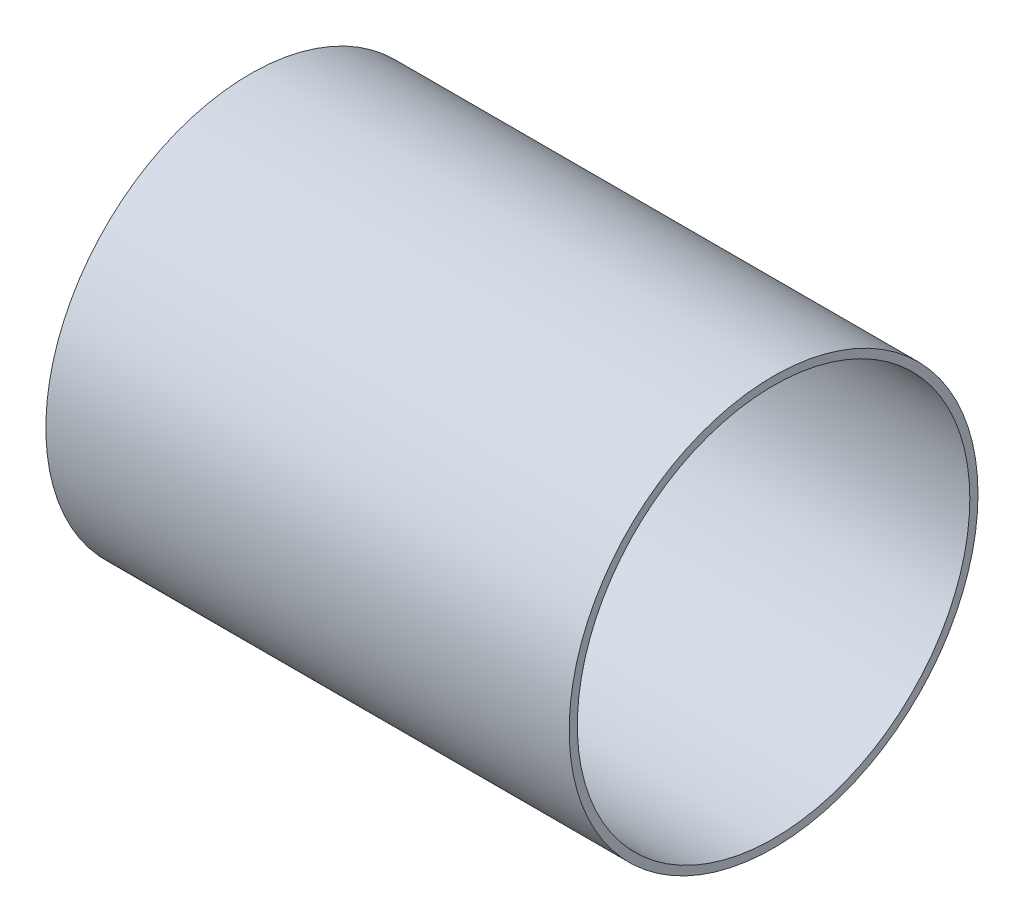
SolidWorks part; units mm, degrees
ref_plane "Front Plane" through (0, 0, 0) normal (1, 0, 0) x (0, 1, 0)
ref_plane "Top Plane" through (0, 0, 0) normal (0, 0, 1) x (0, 1, 0)
ref_plane "Right Plane" through (0, 0, 0) normal (0, 1, 0) x (-1, 0, 0)
sketch "Sketch1" plane through (0, 0, 0) normal (1, 0, 0) x (0, 1, 0)
  circle A0 centre (0, 0) radius 79.375
  circle A1 centre (0, 0) radius 76.2
extrude "Circular_section" add sketch "Sketch1" along normal blind 203.2
